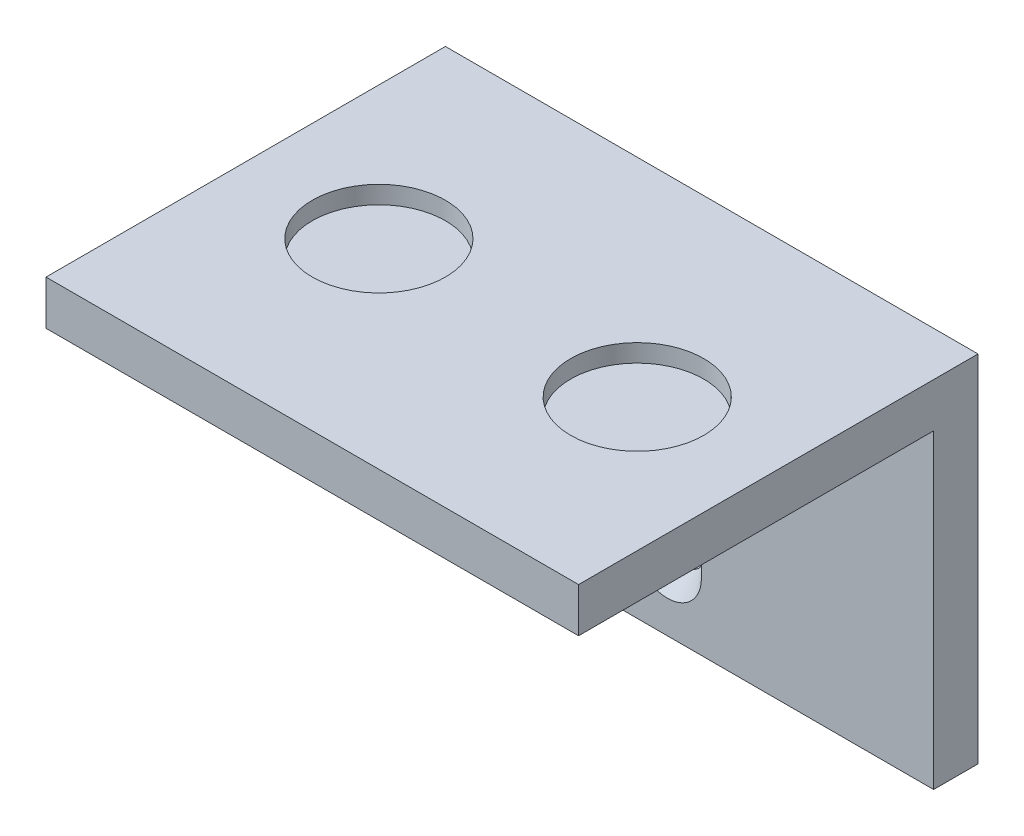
SolidWorks part; units mm, degrees
ref_plane "Front Plane" through (0, 0, 0) normal (0, 0, 1) x (1, 0, 0)
ref_plane "Top Plane" through (0, 0, 0) normal (0, 1, 0) x (1, 0, 0)
ref_plane "Right Plane" through (0, 0, 0) normal (1, 0, 0) x (0, 0, -1)
sketch "Sketch1" plane through (0, 0, 0) normal (0, 0, 1) x (1, 0, 0)
  line L1 (0, 0) -> (152.4, 0)
  line L2 (0, 0) -> (0, 101.6)
  line L3 (0, 101.6) -> (152.4, 101.6)
  line L4 (152.4, 0) -> (152.4, 101.6)
  dimension "D1" = 152.4
  dimension "D2" = 101.6
extrude "Boss-Extrude1" add sketch "Sketch1" along normal blind 12.7
sketch "Sketch3" plane through (0, 0, 12.7) normal (0, 0, 1) x (1, 0, 0)
  line L0 (152.4, 0) -> (152.4, 101.6) construction
  line L1 (0, 101.6) -> (152.4, 101.6)
  line L2 (0, 101.6) -> (0, 88.9)
  line L3 (0, 88.9) -> (152.4, 88.9)
  line L4 (152.4, 101.6) -> (152.4, 88.9)
  dimension "D1" = 12.7
extrude "Boss-Extrude2" add sketch "Sketch3" along normal blind 101.6
ref_plane "Plane1" through (76.2, 0, 0) normal (-1, 0, 0) x (0, 0, 1)
sketch "Sketch20" plane through (0, 101.6, 0) normal (0, 1, 0) x (1, 0, 0)
  line L0 (0, -114.3) -> (0, 0) construction
  line L2 (152.4, 0) -> (0, 0) construction
  circle A0 centre (38.1, -57.15) radius 19.05
  circle A1 centre (114.3, -59.4175) radius 19.05
  dimension "D1" = 38.1
  dimension "D2" = 38.1
  dimension "D3" = 76.2
  dimension "D4" = 38.1
  dimension "D5" = 57.15
extrude "Cut-Extrude3" cut sketch "Sketch20" against normal blind 5.08
sketch "Sketch27" plane through (0, 0, 0) normal (0, 0, 1) x (1, 0, 0)
  line L0 (0, 88.9) -> (0, 0) construction
  line L1 (66.5226, 59.89) -> (66.5226, 19.05) construction
  line L2 (0, 0) -> (152.4, 0) construction
  line L3 (85.8774, 19.05) -> (85.8774, 59.69) construction
  line L8 (71.374, 59.89) -> (71.374, 19.05)
  line L9 (81.026, 59.89) -> (81.026, 19.05)
  arc A0 (85.8774, 59.89) -> (66.5226, 59.89) centre (76.2, 59.89) ccw construction
  arc A2 (66.5226, 19.05) -> (85.8774, 19.05) centre (76.2, 19.05) ccw construction
  arc A3 (81.026, 59.89) -> (71.374, 59.89) centre (76.2, 59.89) ccw
  arc A4 (71.374, 19.05) -> (81.026, 19.05) centre (76.2, 19.05) ccw
  dimension "D4" = 19.3548
  dimension "D5" = 9.652
  dimension "D6" = 19.3548
  dimension "D8" = 9.652
  dimension "D1" = 40.84
  dimension "D2" = 40.64
  dimension "D3" = 19.05
  dimension "D7" = 76.2
extrude "Cut-Extrude4" cut sketch "Sketch27" along normal through all contours A4 L9 A3 L8
sketch "Sketch28" plane through (0, 0, 12.7) normal (0, 0, 1) x (1, 0, 0)
  line L0 (66.5226, 59.89) -> (66.5226, 19.05) construction
  line L1 (85.8774, 19.05) -> (85.8774, 59.89) construction
  arc A0 (85.8774, 59.89) -> (66.5226, 59.89) centre (76.2, 59.89) ccw construction
  arc A1 (66.5226, 19.05) -> (85.8774, 19.05) centre (76.2, 19.05) ccw construction
  arc A2 (81.026, 59.89) -> (71.374, 59.89) centre (76.2, 59.89) ccw construction
  dimension "D2" = 9.6774
  dimension "D3" = 9.6774
  dimension "D1" = 40.84
chamfer "Chamfer1" distance 4.9149 angle 49 4 edges at (76.2, 14.224, 12.7) (81.026, 39.47, 12.7) (71.374, 39.47, 12.7) (76.2, 64.716, 12.7)
